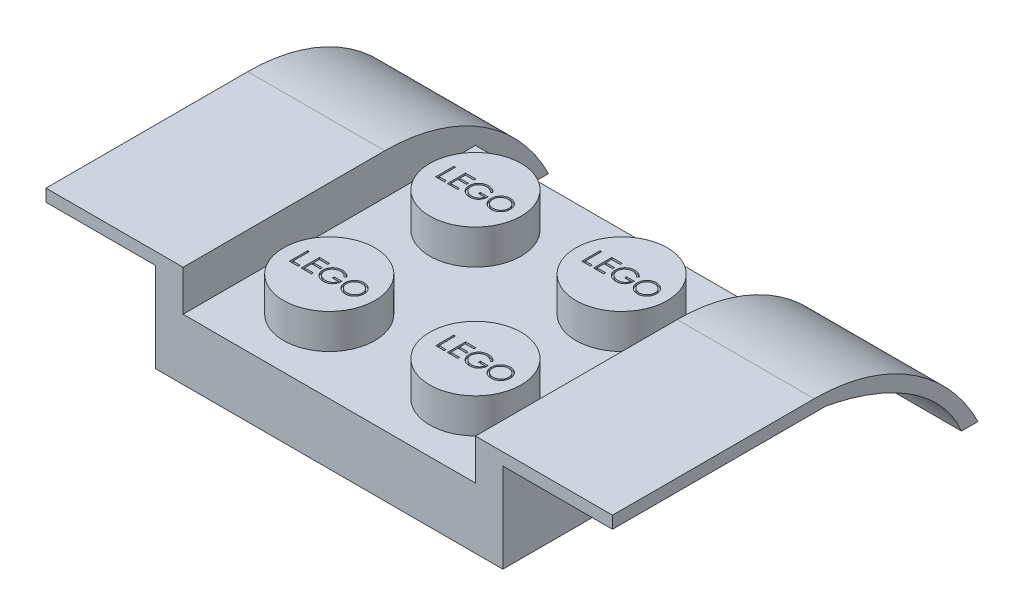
SolidWorks part; units mm, degrees
ref_plane "Plano frontal" through (0, 0, 0) normal (0, 0, 1) x (1, 0, 0)
ref_plane "Plano superior" through (0, 0, 0) normal (0, 1, 0) x (1, 0, 0)
ref_plane "Plano direito" through (0, 0, 0) normal (1, 0, 0) x (0, 0, -1)
sketch "Esboço1" plane through (0, 0, 0) normal (0, 1, 0) x (1, 0, 0)
  line L1 (0, 0) -> (16, 0)
  line L2 (0, 0) -> (0, 16)
  line L3 (0, 16) -> (16, 16)
  line L4 (16, 0) -> (16, 16)
  dimension "D1" = 16
  dimension "D2" = 16
extrude "Ressalto-extrusão1" add sketch "Esboço1" along normal blind 10
sketch "Esboço2" plane through (0, 10, 0) normal (0, 1, 0) x (1, 0, 0)
  line L0 (0, 0) -> (16, 0) construction
  line L1 (16, 0) -> (16, 16) construction
  circle A0 centre (4, 4) radius 2.5
  circle A1 centre (4, 12) radius 2.5
  circle A2 centre (12, 12) radius 2.5
  circle A3 centre (12, 4) radius 2.5
  dimension "D1" = 5
  dimension "D2" = 5
  dimension "D3" = 5
  dimension "D4" = 5
  dimension "D5" = 8
  dimension "D6" = 8
  dimension "D7" = 8
  dimension "D8" = 8
  dimension "D9" = 4
  dimension "D10" = 4
  dimension "D11" = 8
extrude "Ressalto-extrusão2" add sketch "Esboço2" along normal blind 1.9
sketch "Esboço3" plane through (0, 0, 0) normal (0, -1, 0) x (1, 0, 0)
  line L0 (0, 0) -> (16, 0) construction
  line L1 (1, -1) -> (15, -1)
  line L2 (1, -1) -> (1, -15)
  line L3 (1, -15) -> (15, -15)
  line L4 (15, -1) -> (15, -15)
  line L5 (16, -16) -> (0, -16) construction
  line L6 (16, 0) -> (16, -16) construction
  line L7 (0, -16) -> (0, 0) construction
  circle A0 centre (8, -8) radius 3.5
  circle A1 centre (8, -8) radius 2.5
  dimension "D5" = 7
  dimension "D6" = 5
  dimension "D1" = 1
  dimension "D2" = 1
  dimension "D3" = 1
  dimension "D4" = 1
extrude "Corte-extrusão1" cut sketch "Esboço3" against normal blind 9 contours L4 L1 L2 L3 A0 | A1
sketch "Esboço6" plane through (0, 11.9, 0) normal (0, 1, 0) x (1, 0, 0)
  text T0 "LEGO" font "Century Gothic" height 1
extrude "Corte-extrusão2" cut sketch "Esboço6" against normal blind 0.1
pattern_linear "Padrão linear1" count 2 spacing 8 along (0, 0, -1) of "Corte-extrusão2"
pattern_linear "Padrão linear2" count 2 spacing 8 along (1, 0, 0) of "Padrão linear1", "Corte-extrusão2"
pattern_linear "Padrão linear3" count 3 spacing 16 along (0, 0, -1) of "Ressalto-extrusão1", "Ressalto-extrusão2", "Corte-extrusão1", "Corte-extrusão2", "Padrão linear1", "Padrão linear2"
sketch "Esboço7" plane through (0, 0, 0) normal (0, -1, 0) x (1, 0, 0)
  line L1 (1, -15) -> (15, -15)
  line L2 (1, -15) -> (1, -17)
  line L3 (1, -17) -> (15, -17)
  line L4 (15, -15) -> (15, -17)
  line L5 (1, -31) -> (15, -31)
  line L6 (1, -31) -> (1, -33)
  line L7 (1, -33) -> (15, -33)
  line L8 (15, -31) -> (15, -33)
extrude "Corte-extrusão3" cut sketch "Esboço7" against normal up to surface (9 mm away)
sketch "Esboço8" plane through (16, 0, 0) normal (1, 0, 0) x (0, 0, -1)
  line L0 (48, 10) -> (48, 0) construction
  line L1 (0, 0) -> (48, 0)
  line L2 (0, 0) -> (0, 6.6666)
  line L3 (0, 6.6666) -> (48, 6.6666)
  line L4 (48, 0) -> (48, 6.6666)
  dimension "D1" = 6.6666
extrude "Corte-extrusão4" cut sketch "Esboço8" against normal blind 20
sketch "Esboço12" plane through (16, 0, 0) normal (1, 0, 0) x (0, 0, -1)
  line L0 (0, 10) -> (48, 10) construction
  line L1 (16, 10) -> (48, 10)
  line L2 (16, 10) -> (16, 6.6666)
  line L3 (16, 6.6666) -> (48, 6.6666)
  line L4 (48, 10) -> (48, 6.6666)
  line L5 (0, 10) -> (0, 6.6666) construction
  line L7 (16, 10) -> (48, 10)
  line L8 (16, 10) -> (16, 14.4178)
  line L9 (16, 14.4178) -> (48, 14.4178)
  line L10 (48, 10) -> (48, 14.4178)
  dimension "D1" = 16
extrude "Corte-extrusão7" cut sketch "Esboço12" against normal blind 20 contours L10 L9 L8 M6 | L2 M6 M4 M5
sketch "Esboço13" plane through (0, 9, 0) normal (0, -1, 0) x (1, 0, 0)
  line L0 (15, -1) -> (15, -16) construction
  line L1 (1, -16) -> (15, -16)
  line L2 (1, -16) -> (1, -15)
  line L3 (1, -15) -> (15, -15)
  line L4 (15, -16) -> (15, -15)
  dimension "D1" = 1
extrude "Ressalto-extrusão4" add sketch "Esboço13" along normal up to surface (2.3334 mm away)
sketch "Esboço14" plane through (0, 0, 0) normal (0, 0, 1) x (1, 0, 0)
  line L1 (16, 6.6666) -> (23.5, 6.6666)
  line L2 (16, 6.6666) -> (16, 12.2276)
  line L3 (16, 12.2276) -> (23.5, 12.2276)
  line L4 (23.5, 6.6666) -> (23.5, 12.2276)
  dimension "D1" = 7.5
extrude "Ressalto-extrusão5" add sketch "Esboço14" against normal blind 20
fillet "Filete1" radius 10 1 edges at (19.75, 12.2276, -20)
sketch "Esboço15" plane through (23.5, 0, 0) normal (1, 0, 0) x (0, 0, -1)
  line L0 (0, 11.5572) -> (0, 6.6666)
  line L1 (0, 6.6666) -> (0, 12.2276) construction
  line L2 (0, 6.6666) -> (19.0947, 6.6666)
  line L3 (20, 6.6666) -> (0, 6.6666) construction
  line L4 (11.6685, 11.5572) -> (0, 11.5572)
  spline S0 degree 3 poles (11.6685, 11.5572) (14.5667, 11.0304) (17.8556, 9.5542) (19.0947, 6.6666) knots 0 0 0 0 1 1 1 1
extrude "Corte-extrusão8" cut sketch "Esboço15" against normal blind 6
ref_plane "Plano1" through (8, 0, 0) normal (-1, 0, 0) x (0, 0, 1)
mirror "Espelhar1" about plane through (8, 0, 0) normal (-1, 0, 0) of "Corte-extrusão8", "Filete1", "Ressalto-extrusão5"
